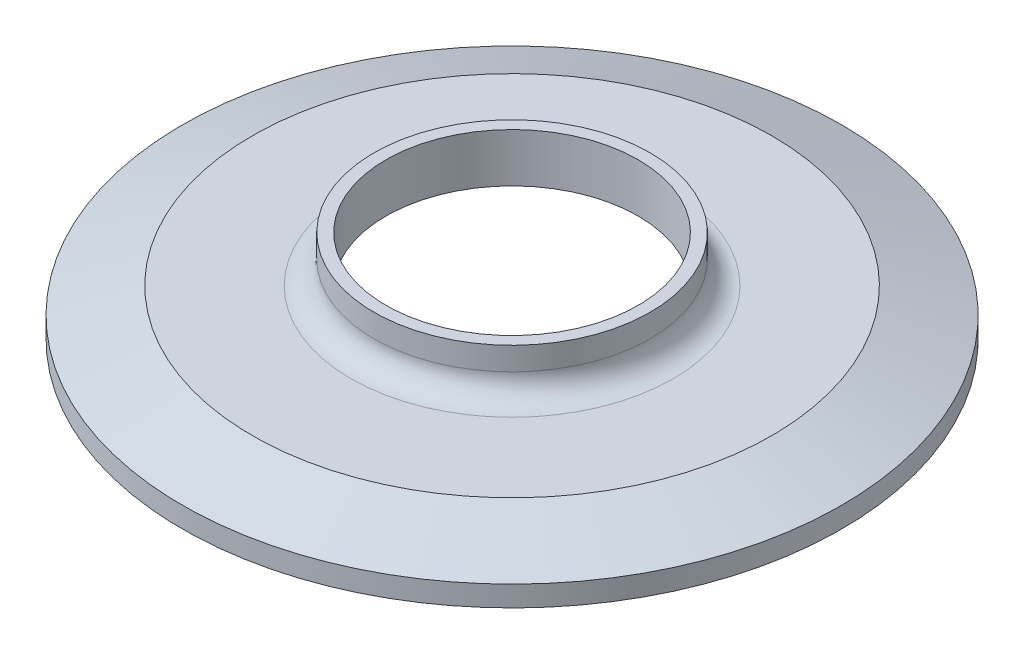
SolidWorks part; units mm, degrees
ref_plane "Front Plane" through (0, 0, 0) normal (0, 0, 1) x (1, 0, 0)
ref_plane "Top Plane" through (0, 0, 0) normal (0, 1, 0) x (1, 0, 0)
ref_plane "Right Plane" through (0, 0, 0) normal (1, 0, 0) x (0, 0, -1)
sketch "Sketch1" plane through (0, 0, 0) normal (0, 0, 1) x (1, 0, 0)
  line L0 (0, 0) -> (0, 8.8532) construction
  line L1 (-19.05, 12.7) -> (-19.05, 9.525)
  line L2 (-22.225, 6.35) -> (-35.8228, 6.35)
  line L3 (-35.8228, 6.35) -> (-45.4533, 2.8448)
  line L4 (-45.4533, 2.8448) -> (-45.4533, 0)
  line L5 (-45.4533, 0) -> (-43.6593, 0.0025)
  line L6 (-36.449, 0) -> (-39.6781, 0.0025)
  line L10 (-36.449, 0) -> (-17.399, 5.9699)
  line L11 (-17.399, 5.9699) -> (-17.399, 12.7)
  line L12 (-17.399, 12.7) -> (-19.05, 12.7)
  line L15 (-42.7676, 0.8754) -> (-42.9345, 0.4823)
  line L17 (-40.5698, 0.8754) -> (-40.4029, 0.4823)
  arc A0 (-22.225, 6.35) -> (-19.05, 9.525) centre (-22.225, 9.525) ccw
  arc A1 (-42.9345, 0.4823) -> (-43.6593, 0.0025) centre (-43.6593, 0.7899) cw
  arc A2 (-39.6781, 0.0025) -> (-40.4029, 0.4823) centre (-39.6781, 0.7899) cw
  arc A3 (-40.5698, 0.8754) -> (-42.7676, 0.8754) centre (-41.6687, 0.4089) ccw
  dimension "D3" = 3.175
  dimension "D7" = 0.7874
  dimension "D8" = 41.6687
  dimension "D9" = 0.7874
  dimension "D2" = 17.399
  dimension "D4" = 12.7
  dimension "D5" = 6.35
  dimension "D6" = 45.4533
  dimension "D10" = 20
  dimension "D11" = 36.449
  dimension "D12" = 19.05
  dimension "D13" = 2.8448
  dimension "D14" = 72.6
revolve "Revolve1" add sketch "Sketch1" angle 360 about L0
